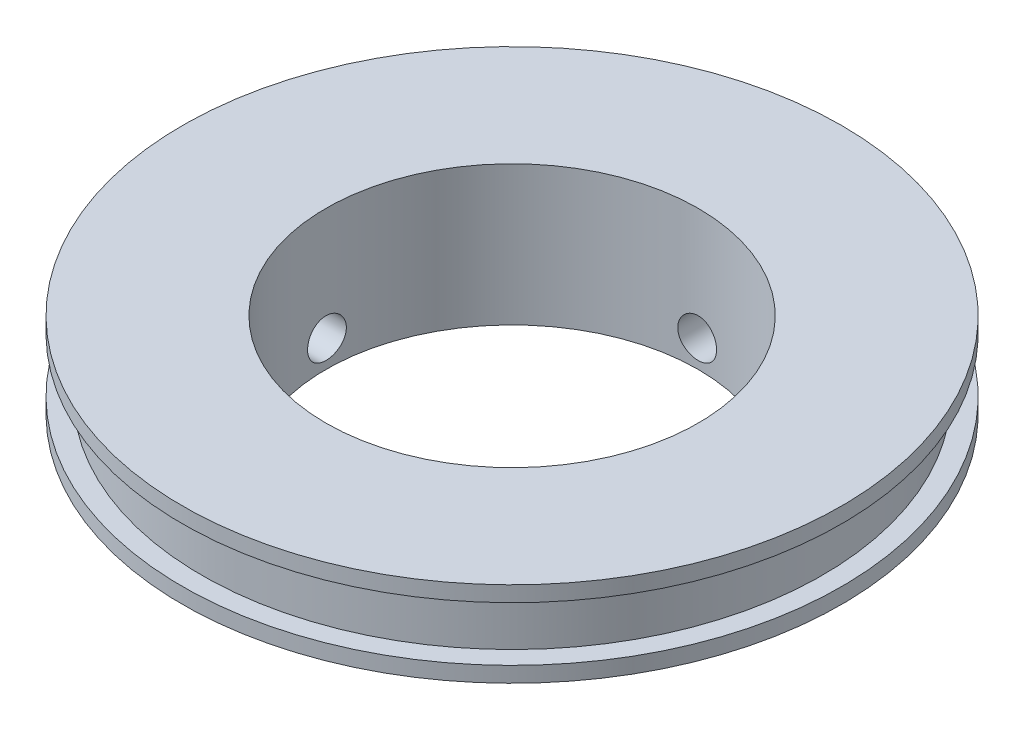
SolidWorks part; units mm, degrees
ref_plane "Front Plane" through (0, 0, 0) normal (0, 0, 1) x (1, 0, 0)
ref_plane "Top Plane" through (0, 0, 0) normal (0, 1, 0) x (1, 0, 0)
ref_plane "Right Plane" through (0, 0, 0) normal (1, 0, 0) x (0, 0, -1)
sketch "Sketch1" plane through (0, 0, 0) normal (0, 0, 1) x (1, 0, 0)
  line L0 (24, 6.1507) -> (42.5, 6.1507)
  line L1 (42.5, 6.1507) -> (42.5, 4.1507)
  line L2 (42.5, 4.1507) -> (40, 4.1507)
  line L3 (40, 4.1507) -> (40, -2.8493)
  line L4 (40, -2.8493) -> (42.5, -2.8493)
  line L5 (42.5, -2.8493) -> (42.5, -4.8493)
  line L6 (42.5, -4.8493) -> (30, -4.8493)
  line L7 (30, -4.8493) -> (30, -11.8493)
  line L8 (30, -11.8493) -> (24, -11.8493)
  line L9 (24, -11.8493) -> (24, 6.1507)
  line L10 (0, 0) -> (0, 6.7884) construction
  dimension "D1" = 24
  dimension "D2" = 42.5
  dimension "D3" = 40
  dimension "D4" = 30
  dimension "D5" = 42.5
  dimension "D6" = 11
  dimension "D7" = 7
  dimension "D8" = 2
  dimension "D9" = 2
revolve "Revolve1" add sketch "Sketch1" angle 360 about L10
sketch "Sketch2" plane through (0, 0, 0) normal (0, 0, 1) x (1, 0, 0)
  line L0 (-30, -11.8493) -> (30, -11.8493) construction
  circle A0 centre (0, -8.3493) radius 2.5
  dimension "D1" = 5
  dimension "D2" = 3.5
extrude "Cut-Extrude1" cut sketch "Sketch2" against normal through all
sketch "Sketch3" plane through (0, 0, 0) normal (1, 0, 0) x (0, 0, -1)
  line L0 (-30, -11.8493) -> (30, -11.8493) construction
  circle A0 centre (0, -8.3493) radius 2.5
  dimension "D1" = 5
  dimension "D2" = 3.5
extrude "Cut-Extrude2" cut sketch "Sketch3" against normal through all
